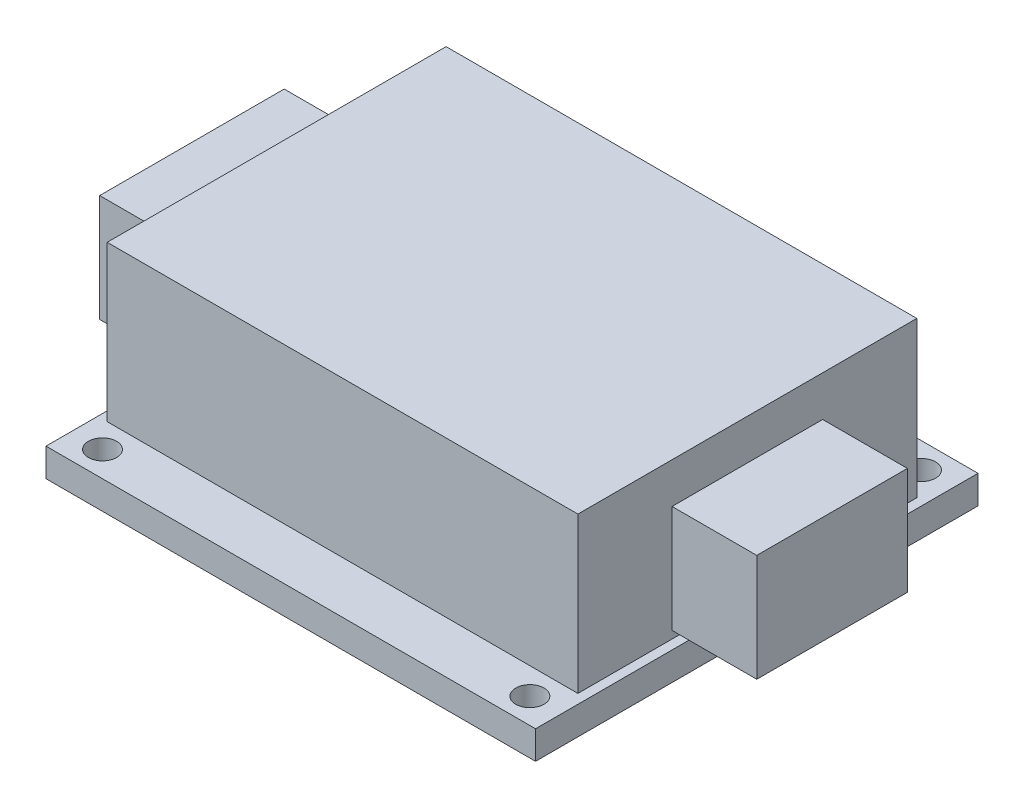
SolidWorks part; units mm, degrees
ref_plane "前视基准面" through (0, 0, 0) normal (0, 0, 1) x (1, 0, 0)
ref_plane "上视基准面" through (0, 0, 0) normal (0, 1, 0) x (1, 0, 0)
ref_plane "右视基准面" through (0, 0, 0) normal (1, 0, 0) x (0, 0, -1)
sketch "草图1" plane through (0, 0, 0) normal (0, 1, 0) x (1, 0, 0)
  line L0 (0, 23.5) -> (0, -23.5) construction
  line L1 (-26, 23.5) -> (26, 23.5)
  line L2 (-26, 23.5) -> (-26, -23.5)
  line L3 (-26, -23.5) -> (26, -23.5)
  line L4 (26, 23.5) -> (26, -23.5)
  line L5 (-26, 23.5) -> (26, -23.5) construction
  line L6 (-26, -23.5) -> (26, 23.5) construction
  circle A0 centre (-22.7, 20.8) radius 1.5
  circle A1 centre (-22.7, -20.8) radius 1.5
  circle A2 centre (22.7, -20.8) radius 1.5
  circle A3 centre (22.7, 20.8) radius 1.5
  point P0 (0, 0)
  dimension "D3" = 3
  dimension "D4" = 45.4
  dimension "D5" = 41.6
  dimension "D6" = 3
  dimension "D7" = 45.4
  dimension "D1" = 52
  dimension "D2" = 47
extrude "凸台-拉伸1" add sketch "草图1" along normal blind 3
sketch "草图2" plane through (0, 3, 0) normal (0, 1, 0) x (1, 0, 0)
  line L1 (-25, 18) -> (25, 18)
  line L2 (-25, 18) -> (-25, -18)
  line L3 (-25, -18) -> (25, -18)
  line L4 (25, 18) -> (25, -18)
  line L5 (-25, 18) -> (25, -18) construction
  line L6 (-25, -18) -> (25, 18) construction
  point P0 (0, 0)
  dimension "D1" = 50
  dimension "D2" = 36
extrude "凸台-拉伸2" add sketch "草图2" along normal blind 16.5
sketch "草图4" plane through (25, 0, 0) normal (1, 0, 0) x (0, 0, -1)
  line L0 (0, 19.5) -> (0, 3) construction
  line L1 (-18, 19.5) -> (18, 19.5) construction
  line L2 (-18, 3) -> (18, 3) construction
  line L3 (-18, 9.5) -> (18, 9.5) construction
  line L4 (-18, 19.5) -> (-18, 3) construction
  line L5 (18, 19.5) -> (18, 3) construction
  line L7 (-8, 15.2) -> (8, 15.2)
  line L8 (-8, 15.2) -> (-8, 3.8)
  line L9 (-8, 3.8) -> (8, 3.8)
  line L10 (8, 15.2) -> (8, 3.8)
  line L11 (-8, 15.2) -> (8, 3.8) construction
  line L12 (-8, 3.8) -> (8, 15.2) construction
  point P12 (0, 9.5)
  dimension "D1" = 11.4
  dimension "D2" = 16
  dimension "D3" = 4.3
extrude "凸台-拉伸4" add sketch "草图4" along normal blind 9
sketch "草图5" plane through (-25, 0, 0) normal (-1, 0, 0) x (0, 0, 1)
  line L0 (0, 19.5) -> (0, 5.3071) construction
  line L1 (-18, 19.5) -> (18, 19.5) construction
  line L2 (-18, 9.5) -> (18, 9.5) construction
  line L3 (-18, 19.5) -> (-18, 3) construction
  line L4 (18, 19.5) -> (18, 3) construction
  line L6 (-9.8, 3.8) -> (9.8, 3.8)
  line L7 (-9.8, 3.8) -> (-9.8, 15.2)
  line L8 (-9.8, 15.2) -> (9.8, 15.2)
  line L9 (9.8, 3.8) -> (9.8, 15.2)
  line L10 (-9.8, 3.8) -> (9.8, 15.2) construction
  line L11 (-9.8, 15.2) -> (9.8, 3.8) construction
  point P11 (0, 9.5)
  dimension "D1" = 11.4
  dimension "D2" = 19.6
  dimension "D3" = 4.3
extrude "凸台-拉伸5" add sketch "草图5" along normal blind 9
